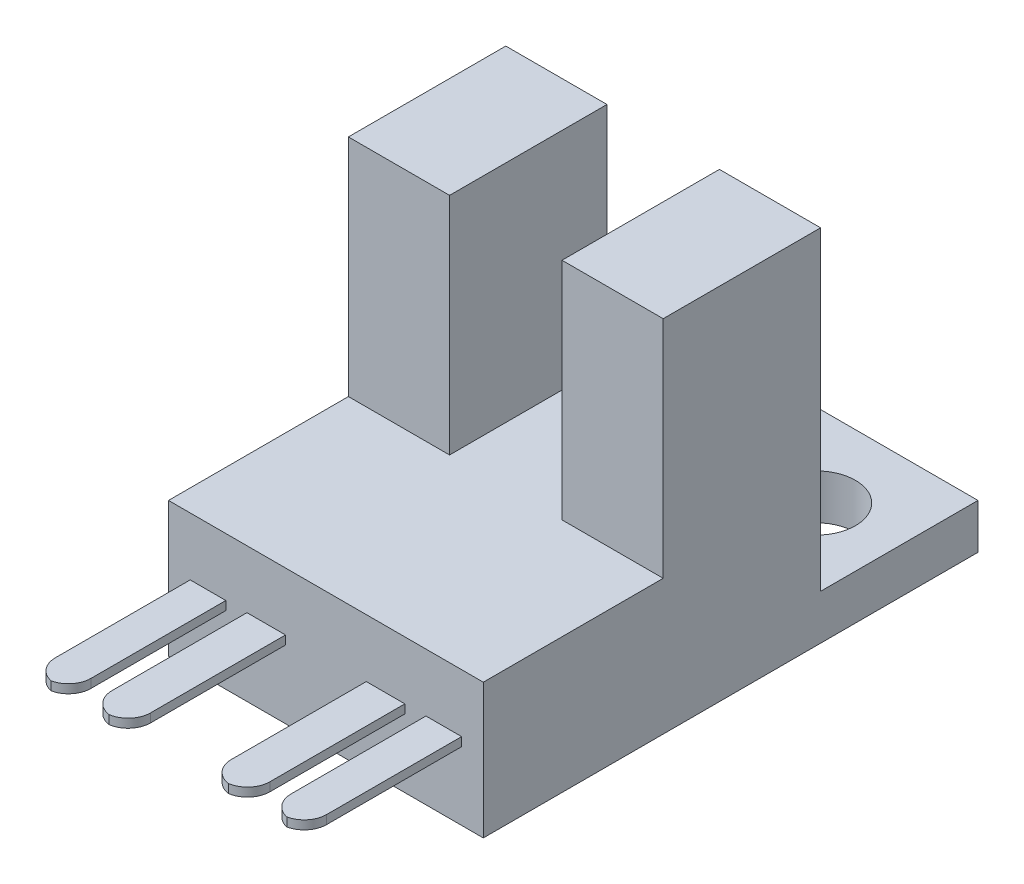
SolidWorks part; units mm, degrees
ref_plane "前视基准面" through (0, 0, 0) normal (0, 0, 1) x (1, 0, 0)
ref_plane "上视基准面" through (0, 0, 0) normal (0, 1, 0) x (1, 0, 0)
ref_plane "右视基准面" through (0, 0, 0) normal (1, 0, 0) x (0, 0, -1)
sketch "草图1" plane through (0, 0, 0) normal (0, 0, 1) x (1, 0, 0)
  line L1 (-7, 16) -> (7, 16)
  line L2 (-7, 16) -> (-7, 0)
  line L3 (-7, 0) -> (7, 0)
  line L4 (7, 16) -> (7, 0)
  dimension "D1" = 7
  dimension "D2" = 14
  dimension "D3" = 16
  dimension "D4" = 0
extrude "凸台-拉伸1" add sketch "草图1" along normal blind 22
sketch "草图2" plane through (0, 16, 0) normal (0, 1, 0) x (1, 0, 0)
  line L0 (7, -22) -> (7, 0) construction
  line L1 (-7, 0) -> (7, 0)
  line L2 (-7, 0) -> (-7, -7)
  line L3 (-7, -7) -> (7, -7)
  line L4 (7, 0) -> (7, -7)
  dimension "D1" = 7
extrude "切除-拉伸1" cut sketch "草图2" against normal blind 14
sketch "草图3" plane through (0, 2, 0) normal (0, 1, 0) x (1, 0, 0)
  line L0 (0, 0) -> (0, -6.0716) construction
  line L1 (-3.5, -3.7) -> (10.2649, -3.7) construction
  line L2 (-3.5, 1.0878) -> (-3.5, -3.7) construction
  line L3 (7, 0) -> (-7, 0) construction
  line L4 (3.5, 1.0878) -> (3.5, -3.7) construction
  circle A0 centre (-3.5, -3.7) radius 1.75
  circle A1 centre (3.5, -3.7) radius 1.75
  dimension "D3" = 3.5
  dimension "D1" = 3.7
  dimension "D2" = 3.5
extrude "切除-拉伸2" cut sketch "草图3" against normal blind 15
sketch "草图4" plane through (0, 16, 0) normal (0, 1, 0) x (1, 0, 0)
  line L0 (-7, -7) -> (7, -7) construction
  line L1 (-10.2861, -14) -> (10.2861, -14)
  line L2 (-10.2861, -14) -> (-10.2861, -26.8331)
  line L3 (-10.2861, -26.8331) -> (10.2861, -26.8331)
  line L4 (10.2861, -14) -> (10.2861, -26.8331)
  line L5 (0, 0) -> (0, -31.3817) construction
  dimension "D1" = 7
  dimension "D2" = 12.8331
  dimension "D3" = 20.5721
extrude "切除-拉伸3" cut sketch "草图4" against normal blind 10
sketch "草图5" plane through (0, 16, 0) normal (0, 1, 0) x (1, 0, 0)
  line L0 (0, 0) -> (0, -24.0898) construction
  line L1 (-2.5, -5.5) -> (2.5, -5.5)
  line L2 (-2.5, -5.5) -> (-2.5, -15.5)
  line L3 (-2.5, -15.5) -> (2.5, -15.5)
  line L4 (2.5, -5.5) -> (2.5, -15.5)
  line L5 (-7, -10.5) -> (8.0416, -10.5) construction
  line L6 (-7, -14) -> (-7, -7) construction
  dimension "D1" = 10
  dimension "D2" = 5
extrude "切除-拉伸4" cut sketch "草图5" against normal blind 10
sketch "草图6" plane through (0, 0, 22) normal (0, 0, 1) x (1, 0, 0)
  line L0 (0, -0.2032) -> (0, 7.5308) construction
  line L1 (-6.0351, 3.4211) -> (-4.4494, 3.4211)
  line L2 (-6.0351, 3.4211) -> (-6.0351, 3.0328)
  line L3 (-6.0351, 3.0328) -> (-4.4494, 3.0328)
  line L4 (-4.4494, 3.4211) -> (-4.4494, 3.0328)
  line L5 (-3.511, 3.4211) -> (-1.796, 3.4211)
  line L6 (-3.511, 3.4211) -> (-3.511, 3.0328)
  line L7 (-3.511, 3.0328) -> (-1.796, 3.0328)
  line L8 (-1.796, 3.4211) -> (-1.796, 3.0328)
  line L9 (1.796, 3.4211) -> (1.796, 3.0328)
  line L10 (3.511, 3.0328) -> (1.796, 3.0328)
  line L11 (3.511, 3.4211) -> (3.511, 3.0328)
  line L12 (3.511, 3.4211) -> (1.796, 3.4211)
  line L13 (4.4494, 3.4211) -> (4.4494, 3.0328)
  line L14 (6.0351, 3.0328) -> (4.4494, 3.0328)
  line L15 (6.0351, 3.4211) -> (6.0351, 3.0328)
  line L16 (6.0351, 3.4211) -> (4.4494, 3.4211)
extrude "凸台-拉伸2" add sketch "草图6" along normal blind 7
fillet "圆角4" radius 1 8 edges at (6.0351, 3.227, 29) (4.4494, 3.227, 29) (3.511, 3.227, 29) (1.796, 3.227, 29) (-1.796, 3.227, 29) (-3.511, 3.227, 29) (-4.4494, 3.227, 29) (-6.0351, 3.227, 29)
